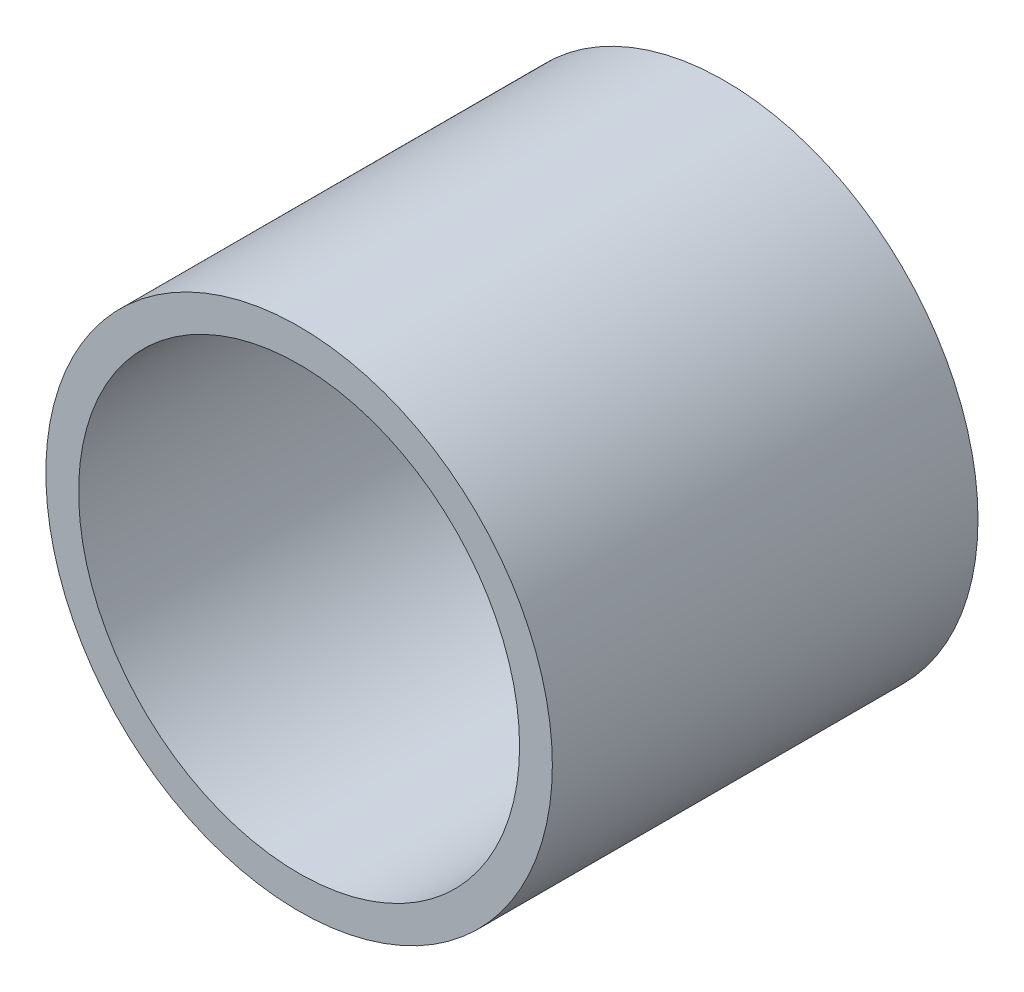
SolidWorks part; units mm, degrees
ref_plane "Front" through (0, 0, 0) normal (0, 0, 1) x (1, 0, 0)
ref_plane "Top" through (0, 0, 0) normal (0, 1, 0) x (1, 0, 0)
ref_plane "Side" through (0, 0, 0) normal (1, 0, 0) x (0, 0, -1)
sketch "PipeSketch"
  dimension "OuterDiameter" = 60.452
  dimension "InnerDiameter" = 52.6288
extrude "Extrusion" add sketch "PipeSketch" along normal blind 50.8
sketch "FilterSketch" plane through (0, 0, 0) normal (0, 0, 1) x (1, 0, 0)
  circle A0 centre (0, 0) radius 25.4 construction
  dimension "NominalDiameter" = 50.8
